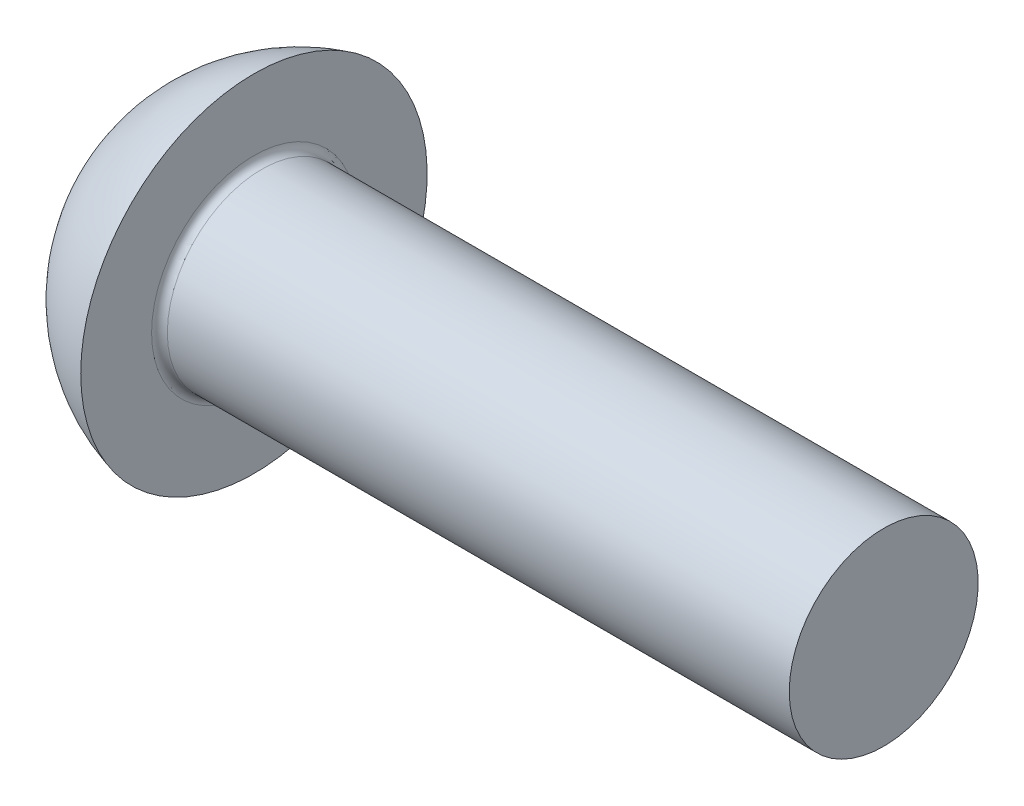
SolidWorks part; units mm, degrees
ref_plane "Front" through (0, 0, 0) normal (0, 0, 1) x (1, 0, 0)
ref_plane "Top" through (0, 0, 0) normal (0, 1, 0) x (1, 0, 0)
ref_plane "Right" through (0, 0, 0) normal (1, 0, 0) x (0, 0, -1)
other "Configuration Table"
sketch "Sketch1" plane through (29.2835, 18.2835, 0) normal (0, 0, 1) x (0, 1, 0)
  line L0 (-18.2835, -19.2165) -> (-18.2835, 29.2835)
  line L1 (-7.2835, 20.7835) -> (-12.2835, 20.7835)
  line L2 (-12.2835, 20.7835) -> (-12.2835, -19.2165)
  line L3 (-18.2835, -19.2165) -> (-12.2835, -19.2165)
  line L4 (-18.2835, -12.7268) -> (-18.2835, -20.1495) construction
  arc A0 (-18.2835, 29.2835) -> (-7.2835, 20.7835) centre (-18.2835, 17.9159) cw
  dimension "l" = 40
  dimension "K" = 8.5
  dimension "d" = 12
  dimension "dk" = 22
revolve "Base-Revolve" add sketch "Sketch1" angle 360 about L4
fillet "Fillet1" radius 0.5 1 edges at (8.5, 0, 6)
